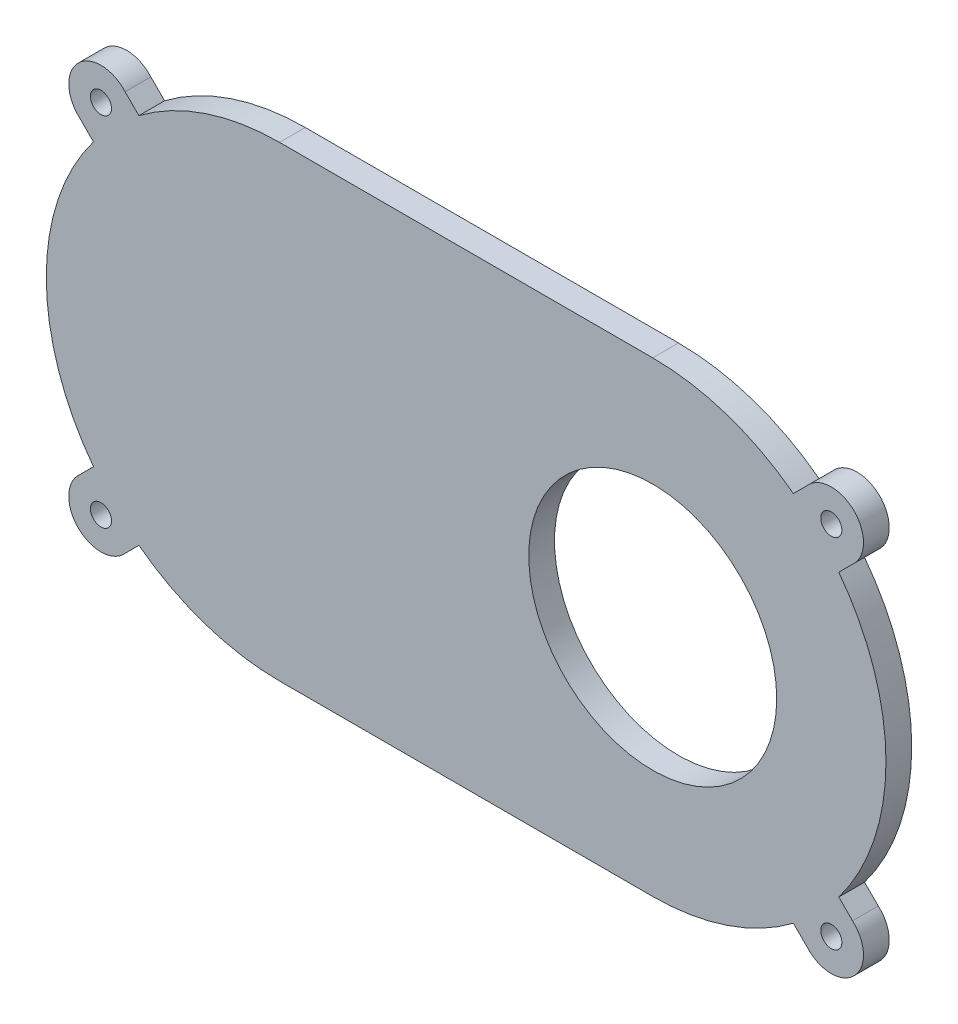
SolidWorks part; units mm, degrees
ref_plane "Front Plane" through (0, 0, 0) normal (0, 0, 1) x (1, 0, 0)
ref_plane "Top Plane" through (0, 0, 0) normal (0, 1, 0) x (1, 0, 0)
ref_plane "Right Plane" through (0, 0, 0) normal (1, 0, 0) x (0, 0, -1)
sketch "Sketch1" plane through (0, 0, 0) normal (0, 0, 1) x (1, 0, 0)
  line L0 (-10.4493, -17.7045) -> (-13.1673, -20.4225) construction
  line L1 (-4.2053, -29.3845) -> (-1.4873, -26.6665) construction
  line L2 (26.2752, -35.9795) -> (99.9352, -35.9795) construction
  line L3 (127.6978, -26.6665) -> (130.4157, -29.3845) construction
  line L4 (139.3777, -20.4225) -> (136.6598, -17.7045) construction
  line L5 (136.6598, 37.8206) -> (139.3777, 40.5385) construction
  line L6 (130.4157, 49.5005) -> (127.6978, 46.7826) construction
  line L7 (99.9352, 56.0955) -> (26.2752, 56.0955) construction
  line L8 (-1.4873, 46.7826) -> (-4.2053, 49.5005) construction
  line L9 (-13.1673, 40.5385) -> (-10.4493, 37.8206) construction
  line L10 (-10.4493, -17.7045) -> (-13.1673, -20.4225)
  line L11 (-4.2053, -29.3845) -> (-1.4873, -26.6665)
  line L12 (26.2752, -35.9795) -> (99.9352, -35.9795)
  line L13 (127.6978, -26.6665) -> (130.4157, -29.3845)
  line L14 (139.3777, -20.4225) -> (136.6598, -17.7045)
  line L15 (136.6598, 37.8206) -> (139.3777, 40.5385)
  line L16 (130.4157, 49.5005) -> (127.6978, 46.7826)
  line L17 (99.9352, 56.0955) -> (26.2752, 56.0955)
  line L18 (-1.4873, 46.7826) -> (-4.2053, 49.5005)
  line L19 (-13.1673, 40.5385) -> (-10.4493, 37.8206)
  arc A0 (-10.4493, 37.8206) -> (-10.4493, -17.7045) centre (26.2752, 10.058) ccw construction
  arc A1 (-13.1673, -20.4225) -> (-4.2053, -29.3845) centre (-8.9723, -25.1895) ccw construction
  arc A2 (-1.4873, -26.6665) -> (26.2752, -35.9795) centre (26.2752, 10.058) ccw construction
  arc A3 (99.9352, -35.9795) -> (127.6978, -26.6665) centre (99.9352, 10.058) ccw construction
  arc A4 (130.4157, -29.3845) -> (139.3777, -20.4225) centre (135.1827, -25.1895) ccw construction
  arc A5 (136.6598, -17.7045) -> (136.6598, 37.8206) centre (99.9352, 10.058) ccw construction
  arc A6 (139.3777, 40.5385) -> (130.4157, 49.5005) centre (135.1827, 45.3055) ccw construction
  arc A7 (127.6978, 46.7826) -> (99.9352, 56.0955) centre (99.9352, 10.058) ccw construction
  arc A8 (26.2752, 56.0955) -> (-1.4873, 46.7826) centre (26.2752, 10.058) ccw construction
  arc A9 (-4.2053, 49.5005) -> (-13.1673, 40.5385) centre (-8.9723, 45.3055) ccw construction
  arc A10 (-10.4493, 37.8206) -> (-10.4493, -17.7045) centre (26.2752, 10.058) ccw
  arc A11 (-13.1673, -20.4225) -> (-4.2053, -29.3845) centre (-8.9723, -25.1895) ccw
  arc A12 (-1.4873, -26.6665) -> (26.2752, -35.9795) centre (26.2752, 10.058) ccw
  arc A13 (99.9352, -35.9795) -> (127.6978, -26.6665) centre (99.9352, 10.058) ccw
  arc A14 (130.4157, -29.3845) -> (139.3777, -20.4225) centre (135.1827, -25.1895) ccw
  arc A15 (136.6598, -17.7045) -> (136.6598, 37.8206) centre (99.9352, 10.058) ccw
  arc A16 (139.3777, 40.5385) -> (130.4157, 49.5005) centre (135.1827, 45.3055) ccw
  arc A17 (127.6978, 46.7826) -> (99.9352, 56.0955) centre (99.9352, 10.058) ccw
  arc A18 (26.2752, 56.0955) -> (-1.4873, 46.7826) centre (26.2752, 10.058) ccw
  arc A19 (-4.2053, 49.5005) -> (-13.1673, 40.5385) centre (-8.9723, 45.3055) ccw
  circle A20 centre (-8.9723, -25.1895) radius 2.0828
  circle A21 centre (-8.9723, 45.3055) radius 2.0828
  circle A22 centre (135.1827, 45.3055) radius 2.0828
  circle A23 centre (135.1827, -25.1895) radius 2.0828
  circle A24 centre (99.9352, 10.058) radius 21.9329 construction
  circle A25 centre (99.9352, 10.058) radius 24.4729
  dimension "D1" = 2.54
extrude "Boss-Extrude1" add sketch "Sketch1" along normal blind 5.08
